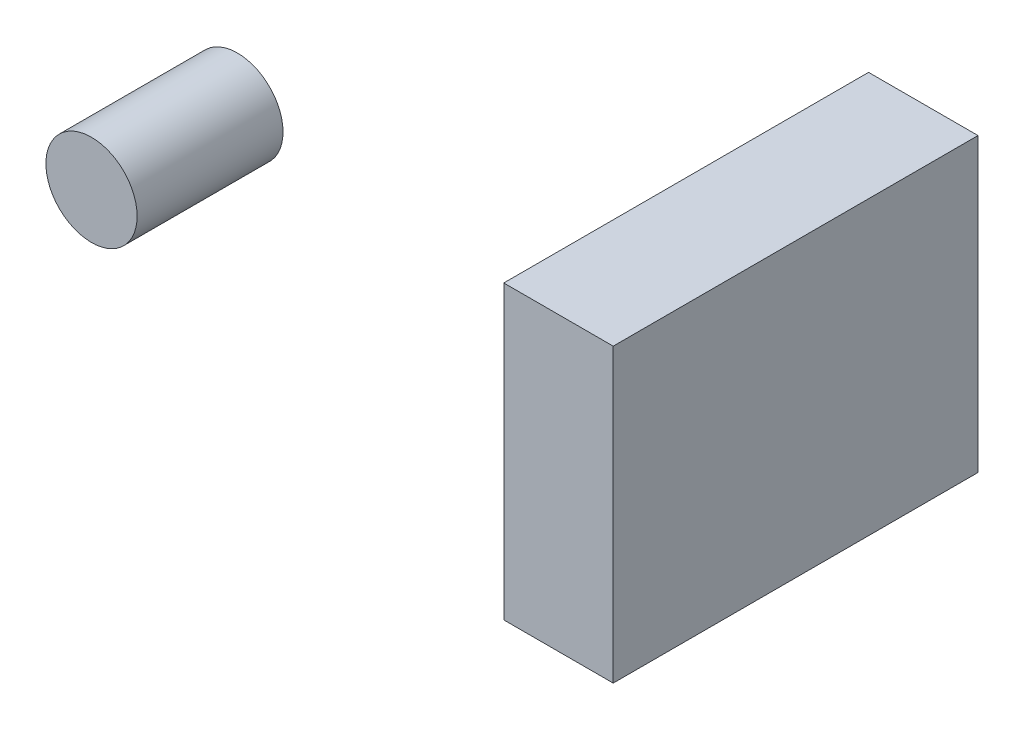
SolidWorks part; units mm, degrees
ref_plane "前视基准面" through (0, 0, 0) normal (0, 0, 1) x (1, 0, 0)
ref_plane "上视基准面" through (0, 0, 0) normal (0, 1, 0) x (1, 0, 0)
ref_plane "右视基准面" through (0, 0, 0) normal (1, 0, 0) x (0, 0, -1)
other "Configuration Table"
sketch "草图1" plane through (0, 0, 0) normal (0, 0, 1) x (1, 0, 0)
  circle A0 centre (-29.024, -20.76) radius 6.25
  dimension "D1" = 12.5
  dimension "D2" = 29.024
  dimension "D3" = 20.76
extrude "C1_nominal_12p5x20" add sketch "草图1" along normal blind 20 from offset 20 separate body
sketch "草图2" plane through (0, 0, 0) normal (0, 0, 1) x (1, 0, 0)
  line L0 (27.484, -43.554) -> (42.484, -43.554)
  line L1 (42.484, -43.554) -> (42.484, -3.554)
  line L2 (42.484, -3.554) -> (27.484, -3.554)
  line L3 (27.484, -3.554) -> (27.484, -43.554)
  dimension "D1" = 27.484
  dimension "D2" = 42.484
  dimension "D3" = 3.554
  dimension "D4" = 43.554
extrude "CN1_assumed_fully_wired_keepout" add sketch "草图2" along normal blind 50 from offset 50 separate body
